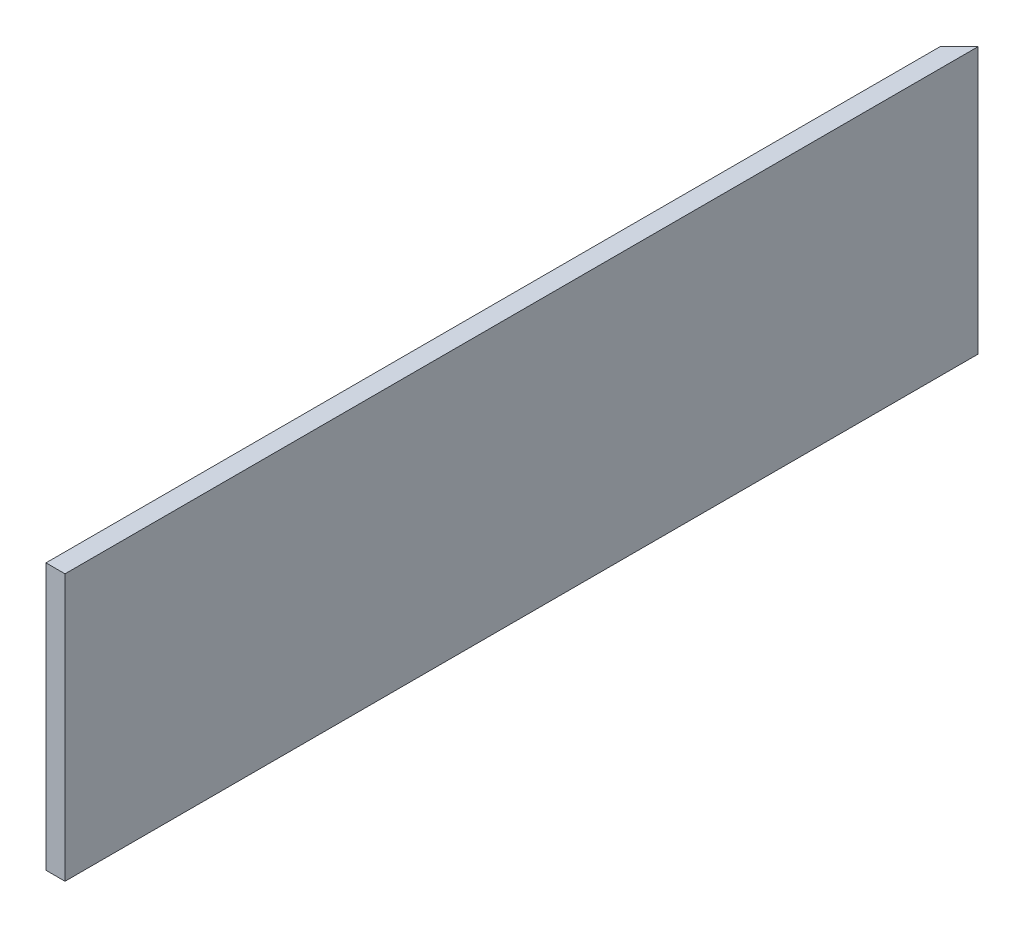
SolidWorks part; units mm, degrees
ref_plane "Front Plane" through (0, 0, 0) normal (0, 0, 1) x (1, 0, 0)
ref_plane "Top Plane" through (0, 0, 0) normal (0, 1, 0) x (1, 0, 0)
ref_plane "Right Plane" through (0, 0, 0) normal (1, 0, 0) x (0, 0, -1)
sketch "Sketch2" plane through (0, 0, 0) normal (0, 1, 0) x (1, 0, 0)
  line L0 (0, 1193.8) -> (25.4, 1219.2)
  line L1 (0, 0) -> (25.4, 0)
  line L2 (0, 0) -> (0, 1193.8)
  line L4 (25.4, 0) -> (25.4, 1193.8)
  line L7 (25.4, 1219.2) -> (25.4, 1193.8)
  line L8 (25.4, 1193.8) -> (0, 1193.8) construction
extrude "Boss-Extrude1" add sketch "Sketch2" along normal blind 355.6
equation "\"system_width\"= 7ft + 10 "
equation "\"system_length\"= 95.5"
equation "\"module_board_length\"= 11.25in"
equation "\"module_board_width\"= 1.5in"
equation "\"module_width\"= (\"system_width\" -  2* \"module_trim_thickness\") / 2"
equation "\"module_length\"= (\"system_top_length\" - \"module_trim_thickness\")/ 2"
equation "\"module_board_long_depth\"= \"module_length\" - \"module_lip_width\""
equation "\"module_board_short_depth\"= \"module_width\" - ( 2 * \"module_board_width\" ) - \"module_lip_width\""
equation "\"module_board_hole\"= 0.5in"
equation "\"module_board_hole_position\"= ( ( \"module_width\" - \"module_board_hole_seperation\" ) / 2 ) + \"module_board_width\"/2"
equation "\"module_board_hole_seperation\"= 20in"
equation "\"module_top_length\"= \"module_length\" + \"module_lip_width\""
equation "\"module_top_width\"= \"module_width\" + \"module_lip_width\""
equation "\"module_top_thickness\"= 0.75in"
equation "\"module_lip_width\"= 1.5in"
equation "\"module_trim_thickness\"= 1in"
equation "\"module_trim_height\"= 14in"
equation "\"D1@Sketch2\"=\"module_width\" +\"module_trim_thickness\""
equation "\"D3@Sketch2\"=\"module_trim_thickness\""
equation "\"D1@Boss-Extrude1\"=\"module_trim_height\""
equation "\"system_step_width\"= 3ft"
equation "\"system_top_length\"= \"system_length\" - \"system_step_length\""
equation "\"step_board_length\"= 5.5in"
equation "\"step_board_width\"= 1.5in"
equation "\"system_step_length\"= 2ft+11.5"
equation "\"module_top_overhang\"= 4.5in"
equation "\"module_trim_angle\"= 45deg"
equation "\"step_module_width\"= \"module_width\""
equation "\"step_module_length\"= \"system_step_length\" - \"module_trim_thickness\""
equation "\"step_board_short_depth\"= \"step_module_length\" - \"module_lip_width\""
equation "\"step_board_long_depth\"= \"step_module_width\" - (2 * \"module_board_width\") - \"module_lip_width\""
